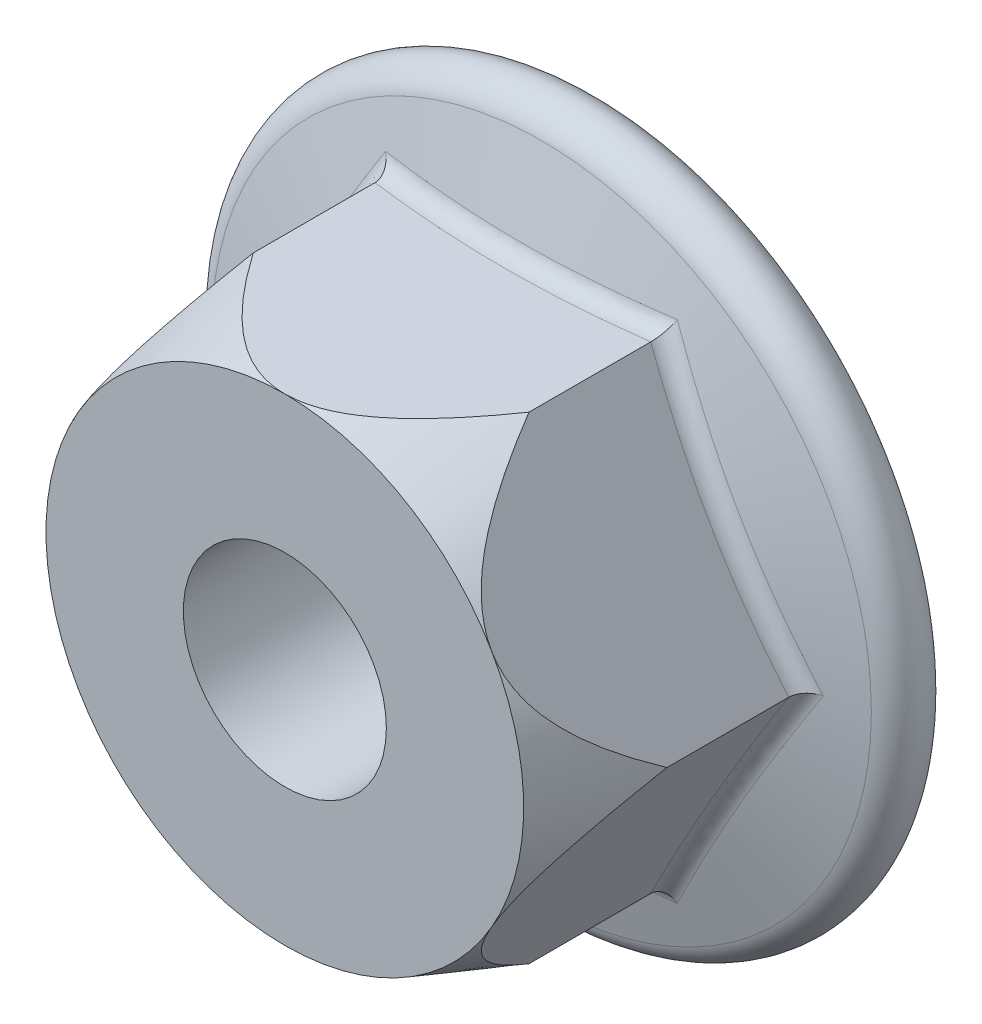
SolidWorks part; units mm, degrees
ref_plane "Front" through (0, 0, 0) normal (0, 0, 1) x (1, 0, 0)
ref_plane "Top" through (0, 0, 0) normal (0, 1, 0) x (1, 0, 0)
ref_plane "Right" through (0, 0, 0) normal (1, 0, 0) x (0, 0, -1)
sketch "Sketch1" plane through (0, 0, 0) normal (0, 0, 1) x (1, 0, 0)
  line L1 (4.6188, 0) -> (2.3094, 4)
  line L2 (2.3094, 4) -> (-2.3094, 4)
  line L3 (-2.3094, 4) -> (-4.6188, 0)
  line L4 (-4.6188, 0) -> (-2.3094, -4)
  line L5 (-2.3094, -4) -> (2.3094, -4)
  line L6 (2.3094, -4) -> (4.6188, 0)
  circle A0 centre (0, 0) radius 4 construction
  dimension "s" = 8
extrude "BaseNut" add sketch "Sketch1" against normal blind 5.3
sketch "Sketch2" plane through (-0.4812, 0, -5.1) normal (0, 1, 0) x (0, 0, -1)
  line L0 (-0.1158, 4.1376) -> (0.2, 4.1376)
  line L2 (0.2, 4.1376) -> (0.2, 2.9588)
  line L4 (0.2, 2.9588) -> (-0.1158, 4.1376)
  line L5 (-3.32, 4.1376) -> (-5.1, 4.1376)
  line L6 (-5.1, 4.1376) -> (-5.1, 3.5188)
  line L8 (-5.1, 3.5188) -> (-3.32, 4.1376)
  line L9 (0, -0.4812) -> (-5.5811, -0.4812) construction
  line L10 (-5.1, 1.8282) -> (-5.1, 4.1376) construction
  line L11 (0.2, 4.1376) -> (-5.1, 4.1376) construction
  line L12 (0.2, 4.1376) -> (0.2, 1.8282) construction
  dimension "e" = 8
  dimension "D" = 6.88
  dimension "m" = 3.52
  dimension "D4" = 15
revolve "Double-Chamfer" cut sketch "Sketch2" angle 360 about L9
sketch "Sketch3" plane through (0, 0, 0) normal (0, 0, 1) x (1, 0, 0)
  circle A0 centre (0, 0) radius 1.7
  dimension "D1" = 3.4
extrude "Hole" cut sketch "Sketch3" against normal through all
chamfer "EndChamfer" distance 0.4857 angle 45 1 edges at (1.7, 0, -5.3)
sketch "Sketch4" plane through (0.0678, 0, -5.8322) normal (0, 1, 0) x (0, 0, -1)
  line L0 (-0.5322, 3.5078) -> (-0.5322, 5.4592)
  line L1 (-1.365, 5.5908) -> (-1.5322, 5.5908) construction
  line L2 (-1.5322, 5.5908) -> (-1.7744, 4.6866)
  line L3 (-0.5322, 4.6866) -> (-0.5322, 3.5078) construction
  line L4 (-1.7744, 4.6866) -> (-1.7744, 3.5078) construction
  line L5 (-1.7744, 3.5078) -> (-0.5322, 3.5078)
  line L6 (-0.0801, 0.0678) -> (-7.1294, 0.0678) construction
  line L8 (-1.7744, 3.5078) -> (-2.0903, 3.5078)
  line L9 (-1.7744, 4.6866) -> (-2.0903, 3.5078)
  line L12 (-0.848, 4.6866) -> (-4.0522, 4.6866) construction
  arc A0 (-0.5322, 5.4592) -> (-1.5322, 5.5908) centre (-1.0408, 5.4592) ccw
  dimension "D1" = 11.8
  dimension "h1" = 1
  dimension "D2" = 15
revolve "Flange" add sketch "Sketch4" angle 360 about L6
fillet "FlangeFillet" radius 0.3 6 edges
sketch "Sketch5" plane through (0, 0, 0) normal (0, 1, 0) x (1, 0, 0)
  line L0 (0, 6.0366) -> (0, -0.8862) construction
  line L1 (1.4, 4.9643) -> (1.7, 4.9643)
  line L2 (1.7, 4.9643) -> (1.9598, 4.8143)
  line L3 (1.9598, 4.8143) -> (1.7, 4.6643)
  line L4 (1.7, 4.6643) -> (1.4, 4.6643)
  line L5 (1.4, 4.6643) -> (1.4, 4.9643)
  line L6 (1.7, 4.8143) -> (-1.7, 4.8143) construction
  dimension "D1" = 0.3
  dimension "D2" = 3.4
revolve "Cut-Revolve10" [suppressed] cut sketch "Sketch5" angle 360 about L0
pattern_linear "LPattern10" [suppressed] count 13 spacing 0.36
equation "\"e@Sketch2\" = \"s@Sketch1\""
equation "\"D1@EndChamfer\" = \"D1@Sketch3\" / 7"
equation "\"D2@Sketch5\" = \"D1@Sketch3\""
equation "\"D1@Sketch5\" = (  \"D2@ThreadCosmetic1\" - \"D1@Sketch3\" )  / 2"
equation "\"D3@LPattern10\" = \"D1@Sketch5\" * 1.2"
equation "\"D1@LPattern10\" =  ( \"h@BaseNut\"  - \"D1@EndChamfer\" ) / \"D3@LPattern10\" "
